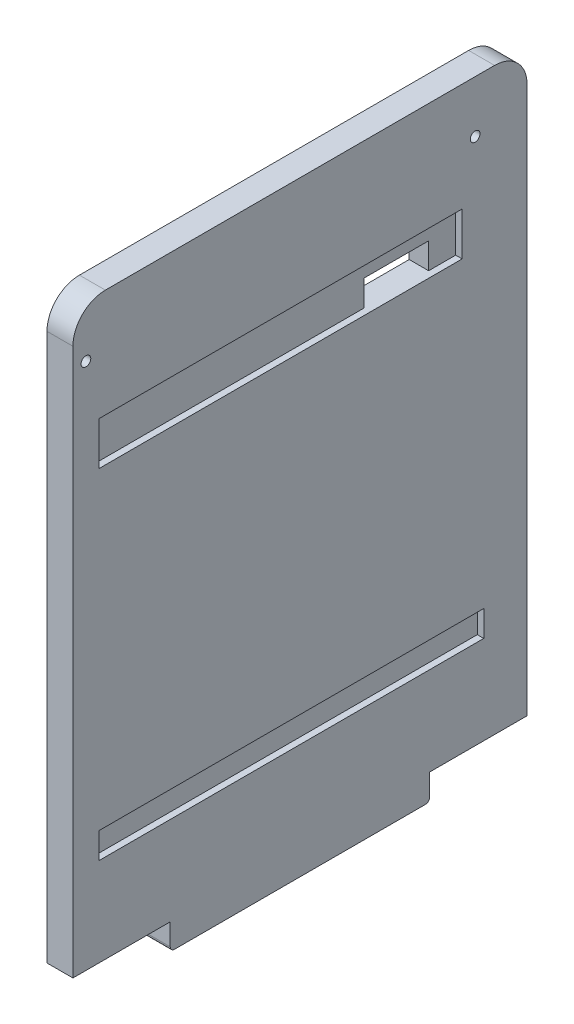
SolidWorks part; units mm, degrees
ref_plane "Front Plane" through (0, 0, 0) normal (0, 0, 1) x (1, 0, 0)
ref_plane "Top Plane" through (0, 0, 0) normal (0, 1, 0) x (1, 0, 0)
ref_plane "Right Plane" through (0, 0, 0) normal (1, 0, 0) x (0, 0, -1)
body saved out of another part "Stock-Donut Shop-1"
hole_wizard "Ø4.0mm Dowel Hole1" positions "3DSketch1" profile "Sketch1" hole size "Ø4.0" standard "ANSI Metric"
sketch3d "3DSketch1"
  point P0 (48, 47, -99)
  point P3 (48, 47, 99)
  point P6 (48, 216, -84)
  point P9 (48, 24, -99)
  point P13 (48, 24, 99)
sketch "Sketch1" plane through (48, 47, -99) normal (0, 1, 0) x (0, 0, 1)
  line L0 (0, 0) -> (0, 6)
  line L1 (0, 6) -> (2, 6)
  line L2 (2, 6) -> (2, 0)
  line L3 (2, 0) -> (0, 0)
  line L4 (0, 6) -> (-2, 6) construction
  line L5 (0, -6.35) -> (0, 107.95) construction
  dimension "Hole Dia." = 4
  dimension "Hole Depth" = 6
  dimension "Drill Angle" = 180
hole_wizard "Ø4.0mm Dowel Hole2" positions "3DSketch2" profile "Sketch2" hole size "Ø4.0" standard "ANSI Metric"
sketch3d "3DSketch2"
  point P0 (48, 47, -99)
  point P4 (48, 47, 99)
  point P8 (48, 216, -84)
  point P11 (48, 24, -99)
  point P14 (48, 24, 99)
sketch "Sketch2" plane through (48, 47, -99) normal (0, 1, 0) x (0, 0, -1)
  line L0 (0, 0) -> (0, 14)
  line L1 (0, 14) -> (2, 14)
  line L2 (2, 14) -> (2, 0)
  line L3 (2, 0) -> (0, 0)
  line L4 (0, 14) -> (-2, 14) construction
  line L5 (0, -6.35) -> (0, 107.95) construction
  dimension "Hole Dia." = 4
  dimension "Hole Depth" = 14
  dimension "Drill Angle" = 180
hole_wizard "CBORE for M4 Pan Head Machine Screw1" positions "Sketch3" profile "Sketch4" counterbore size "M4" standard "ANSI Metric"
sketch "Sketch3" plane through (48, 0, 0) normal (-1, 0, 0) x (0, 0, 1)
  point P0 (-81, 256)
  point P3 (99, 256)
sketch "Sketch4" plane through (48, 256, -81) normal (0, 1, 0) x (0, 0, 1)
  line L0 (0, 0) -> (0, 30)
  line L1 (0, 30) -> (2.25, 28.6481)
  line L2 (2.25, 28.6481) -> (2.25, 3.1)
  line L3 (2.25, 3.1) -> (4.5, 3.1)
  line L4 (4.5, 3.1) -> (4.5, 0)
  line L5 (4.5, 0) -> (0, 0)
  line L6 (0, 30) -> (-2.25, 28.6481) construction
  line L7 (0, -6.35) -> (0, 107.95) construction
  dimension "Hole Dia." = 4.5
  dimension "Hole Depth" = 30
  dimension "C'Bore Dia." = 9
  dimension "C'Bore Depth" = 3.1
  dimension "Drill Angle" = 118
